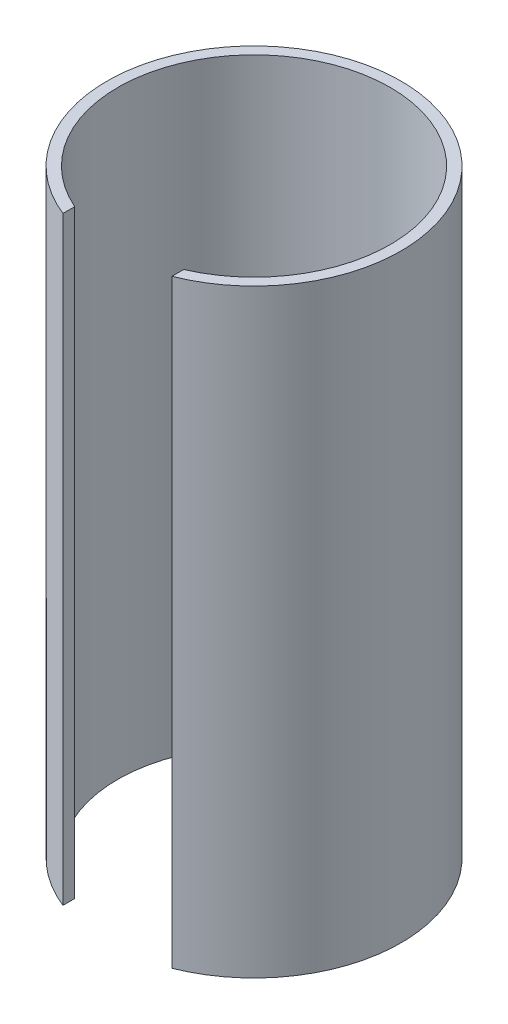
SolidWorks part; units mm, degrees
ref_plane "Front" through (0, 0, 0) normal (0, 0, 1) x (1, 0, 0)
ref_plane "Top" through (0, 0, 0) normal (0, 1, 0) x (1, 0, 0)
ref_plane "Right" through (0, 0, 0) normal (1, 0, 0) x (0, 0, -1)
sketch "Sketch1" plane through (0, 0, 0) normal (0, 1, 0) x (1, 0, 0)
  line L1 (-5, -11.4564) -> (-5, -12.5399)
  line L2 (5, -11.4564) -> (5, -12.5399)
  arc A0 (5, -11.4564) -> (-5, -11.4564) centre (0, 0) ccw
  arc A1 (5, -12.5399) -> (-5, -12.5399) centre (0, 0) ccw
  circle A2 centre (0, 0) radius 12.5 construction
  circle A3 centre (0, 0) radius 13.5 construction
extrude "Extrude1" add sketch "Sketch1" along normal blind 55
